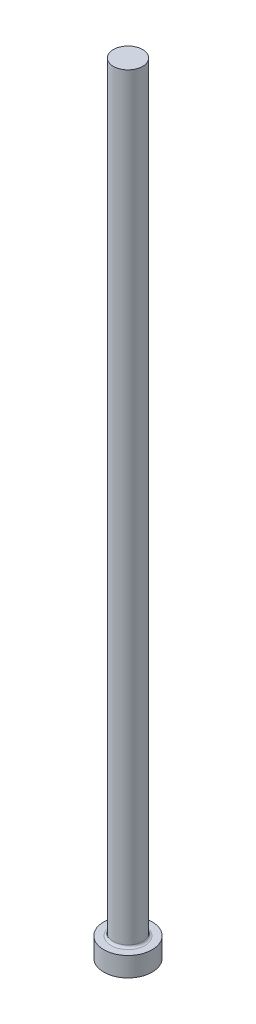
SolidWorks part; units mm, degrees
ref_plane "Front Plane" through (0, 0, 0) normal (0, 0, 1) x (1, 0, 0)
ref_plane "Top Plane" through (0, 0, 0) normal (0, 1, 0) x (1, 0, 0)
ref_plane "Right Plane" through (0, 0, 0) normal (1, 0, 0) x (0, 0, -1)
sketch "Sketch1" plane through (0, 0, 0) normal (0, 0, 1) x (1, 0, 0)
  line L0 (0, 0) -> (7.874, 0)
  line L1 (55, 0) -> (-55, 0) construction
  line L2 (7.874, 0) -> (7.874, 6.35)
  line L3 (7.874, 6.35) -> (5.5245, 6.35)
  line L4 (4.7625, 7.112) -> (4.7625, 254)
  line L5 (4.7625, 254) -> (0, 254)
  line L6 (0, 254) -> (0, 0)
  arc A0 (5.5245, 6.35) -> (4.7625, 7.112) centre (5.5245, 7.112) cw
  dimension "D5" = 0.762
  dimension "D1" = 4.7625
  dimension "D2" = 7.874
  dimension "D3" = 6.35
  dimension "D4" = 254
revolve "Revolve1" add sketch "Sketch1" angle 360 about L6
